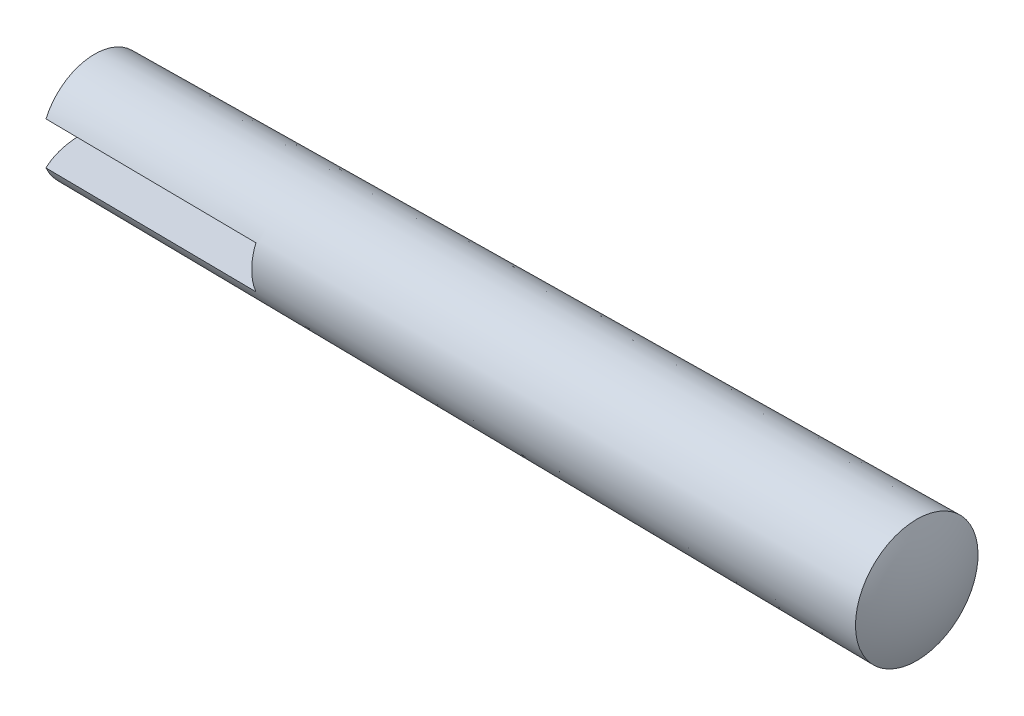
SolidWorks part; units mm, degrees
ref_plane "Plane1" through (0, 0, 0) normal (0, 0, 1) x (1, 0, 0)
ref_plane "Plane2" through (0, 0, 0) normal (0, 1, 0) x (1, 0, 0)
ref_plane "Plane3" through (0, 0, 0) normal (1, 0, 0) x (0, 0, -1)
other "Configuration Table"
sketch "Clipboard" plane through (0, 0, 0) normal (0, 0, 1) x (1, 0, 0)
  line L0 (0, 0) -> (10, 0)
ref_plane "SplitPlane" through (10.63, 0, 0) normal (1, 0, 0) x (0, 0, -1)
sketch "BodySke" plane through (0, 0, 0) normal (0, 0, 1) x (1, 0, 0)
  line L0 (0, 0) -> (210, 0) construction
  line L2 (0.63, 2.5) -> (39.37, 2.8874)
  line L4 (0, 0) -> (40, 0)
  line L5 (0.63, -2.5) -> (39.37, -2.8874) construction
  arc A0 (0.63, 2.5) -> (0, 0) centre (5.2753, 0) ccw
  arc A1 (39.37, 2.8874) -> (40, 0) centre (33.0683, 0) cw
revolve "Body" add sketch "BodySke" angle 360 about L0
sketch "SplSke" plane through (10.63, 0, 0) normal (1, 0, 0) x (0, 0, -1)
  line L0 (-20, 0) -> (20, 0) construction
  line L1 (0, 20) -> (0, -20) construction
  line L3 (-2.8874, -1) -> (2.8874, -1)
  line L4 (-2.8874, -1) -> (-2.8874, 1)
  line L5 (-2.8874, 1) -> (2.8874, 1)
  line L6 (2.8874, -1) -> (2.8874, 1)
  circle A0 centre (0, 0) radius 2.8874 construction
  dimension "Width" = 2
extrude "Split" cut sketch "SplSke" against normal through all
equation "\"D1@BodySke\" = \"Crown_ht@BodySke\""
equation "\"Offset@SplitPlane\" = \"SplitDepth@Clipboard\" + \"Crown_ht@BodySke\""
